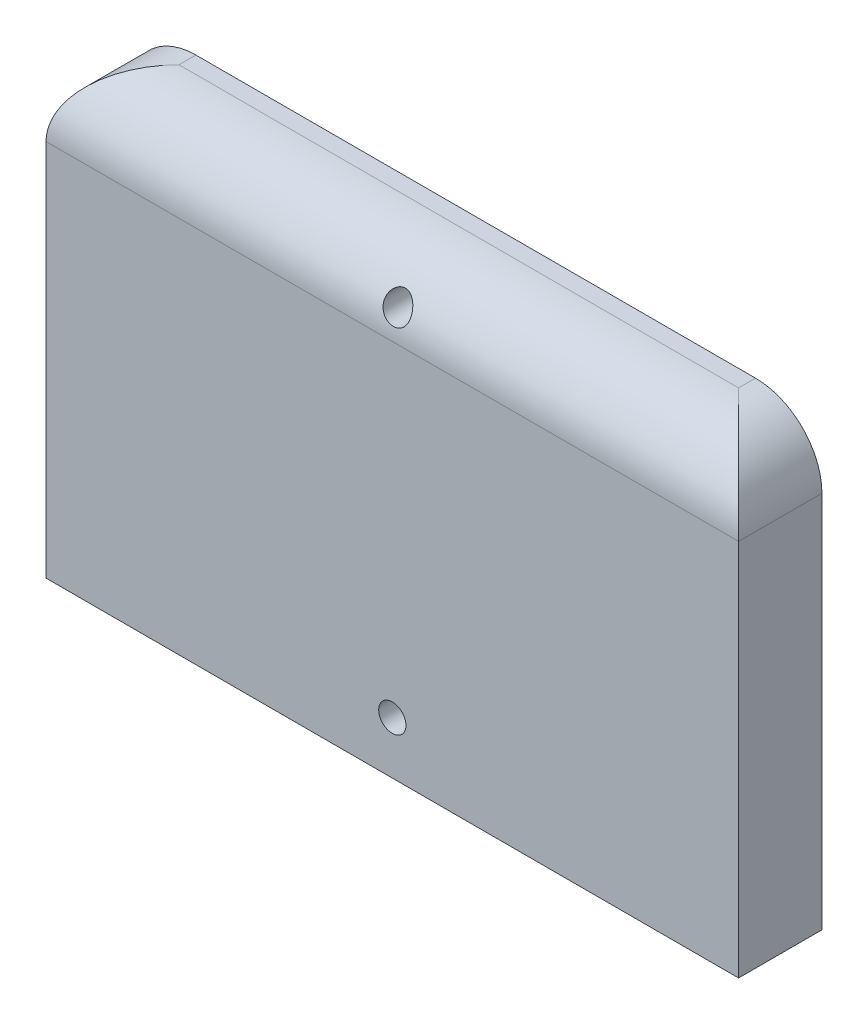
SolidWorks part; units mm, degrees
ref_plane "Front Plane" through (0, 0, 0) normal (0, 0, 1) x (1, 0, 0)
ref_plane "Top Plane" through (0, 0, 0) normal (0, 1, 0) x (1, 0, 0)
ref_plane "Right Plane" through (0, 0, 0) normal (1, 0, 0) x (0, 0, -1)
sketch "Sketch1" plane through (0, 0, 0) normal (0, 0, 1) x (1, 0, 0)
  line L1 (31.75, -20.3835) -> (-31.75, -20.3835)
  line L2 (31.75, -20.3835) -> (31.75, 20.3835)
  line L3 (31.75, 20.3835) -> (-31.75, 20.3835)
  line L4 (-31.75, -20.3835) -> (-31.75, 20.3835)
  line L5 (31.75, -20.3835) -> (-31.75, 20.3835) construction
  line L6 (31.75, 20.3835) -> (-31.75, -20.3835) construction
  point P0 (0, 0)
  dimension "D1" = 40.767
  dimension "D2" = 63.5
extrude "Boss-Extrude1" add sketch "Sketch1" along normal blind 2.54 and the other way blind 5.1042
fillet "Fillet1" radius 6.096 3 edges at (31.75, 20.3835, -1.2821) (0, 20.3835, 2.54) (-31.75, 20.3835, -1.2821)
sketch "Sketch8" plane through (0, 0, 2.54) normal (0, 0, 1) x (1, 0, 0)
  point P0 (0, -15.5836)
  point P1 (0, 16.6744)
  point P2 (0, 0)
  point P3 (0, 13.7168)
  point P4 (0, 16.404)
  point P5 (0, -17.1162)
  point P6 (0, 0)
  point P7 (0, 0)
  point P8 (0, 18.4143)
  point P9 (0, 0)
  point P10 (0, 0)
  point P11 (0, 0)
  point P12 (0, 0)
  dimension "D1" = 32.258
hole_wizard "Hole3" positions "Sketch11" profile "Sketch12" legacy
sketch "Sketch11" plane through (0, 0, 2.54) normal (0, 0, 1) x (1, 0, 0)
  point P0 (0, -15.5836)
  point P3 (0, 16.6744)
sketch "Sketch12" plane through (0, -15.5836, 2.54) normal (1, 0, 0) x (0, -1, 0)
  line L0 (0, 0) -> (0, 7.6442)
  line L1 (0, 7.6442) -> (1.25, 7.6442)
  line L2 (1.25, 7.6442) -> (1.25, 0)
  line L3 (1.25, 0) -> (0, 0)
  line L4 (0, 110) -> (0, -10) construction
  dimension "Diameter" = 2.5
  dimension "Depth" = 7.6442
sketch "Sketch13" plane through (31.75, 0, 0) normal (1, 0, 0) x (0, 0, -1)
